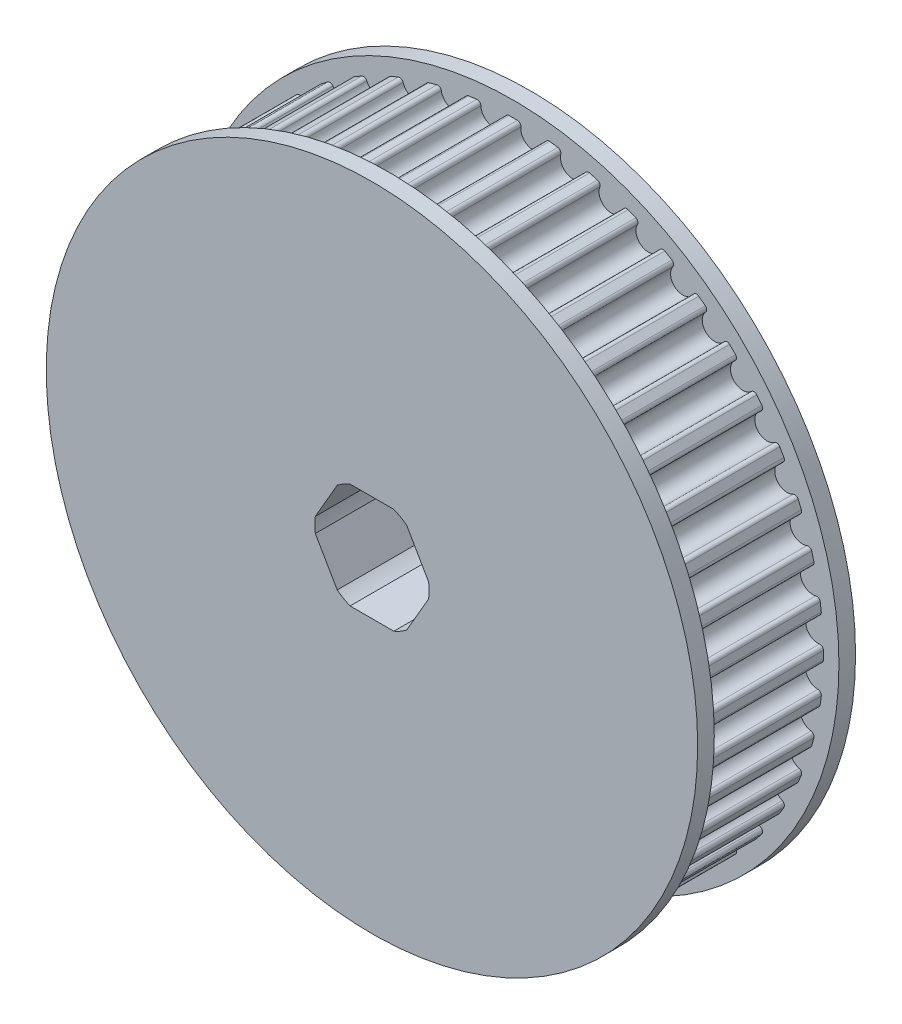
SolidWorks part; units mm, degrees
ref_plane "Front Plane" through (0, 0, 0) normal (0, 0, 1) x (1, 0, 0)
ref_plane "Top Plane" through (0, 0, 0) normal (0, 1, 0) x (1, 0, 0)
ref_plane "Right Plane" through (0, 0, 0) normal (1, 0, 0) x (0, 0, -1)
sketch "Sketch2" plane through (0, 0, 0) normal (0, 0, 1) x (1, 0, 0)
  circle A0 centre (0, 0) radius 38.1972
extrude "PD" add sketch "Sketch2" along normal mid plane 15
sketch "Sketch3" plane through (0, 0, 7.5) normal (0, 0, 1) x (1, 0, 0)
  line L0 (0, 0) -> (0, 37.3272) construction
  line L1 (0, 0) -> (2.404, 36.6785) construction
  line L2 (0, 37.3272) -> (0.4965, 37.3272)
  line L3 (0, 37.3272) -> (0, 38.1972)
  line L4 (4.8722, 37.0078) -> (4.9857, 37.8704)
  line L5 (4.8722, 37.0078) -> (4.3799, 37.0727)
  line L6 (2.404, 36.6785) -> (2.4982, 38.1154) construction
  arc A0 (0.4965, 37.3272) -> (0.9237, 36.8482) centre (0.4965, 36.8972) cw
  arc A1 (0.9237, 36.8482) -> (3.8938, 36.6535) centre (2.404, 36.6785) ccw
  circle A2 centre (0, 0) radius 38.1972 construction
  arc A3 (0, 38.1972) -> (4.9857, 37.8704) centre (0, 0) cw
  arc A4 (4.3799, 37.0727) -> (3.8938, 36.6535) centre (4.3238, 36.6463) ccw
  point P8 (2.3066, 35.1917)
extrude "Teeth" cut sketch "Sketch3" against normal up to surface (15 mm away)
pattern_circular "CirPattern1" count 48 over 360 about axis through (0, 0, 0) along (0, 0, 1) of "Teeth"
sketch "Sketch4" plane through (0, 0, 7.5) normal (0, 0, 1) x (1, 0, 0)
  circle A0 centre (0, 0) radius 39.1972
extrude "Flange" add sketch "Sketch4" along normal blind 2
mirror "Flange 2" about plane through (0, 0, 0) normal (0, 0, 1) of "Flange"
sketch "Sketch6" plane through (0, 0, 0) normal (0, 0, 1) x (1, 0, 0)
  line L1 (6.8168, 0.893) -> (4.1818, 5.457)
  line L2 (2.635, 6.35) -> (-2.635, 6.35)
  line L3 (-4.1818, 5.457) -> (-6.8168, 0.893)
  line L4 (-6.8168, -0.893) -> (-4.1818, -5.457)
  line L5 (-2.635, -6.35) -> (2.635, -6.35)
  line L6 (4.1818, -5.457) -> (6.8168, -0.893)
  circle A0 centre (0, 0) radius 6.35 construction
  arc A1 (-2.635, 6.35) -> (-4.1818, 5.457) centre (0, 0) ccw
  arc A2 (-6.8168, 0.893) -> (-6.8168, -0.893) centre (0, 0) ccw
  arc A3 (-4.1818, -5.457) -> (-2.635, -6.35) centre (0, 0) ccw
  arc A4 (2.635, -6.35) -> (4.1818, -5.457) centre (0, 0) ccw
  arc A5 (6.8168, -0.893) -> (6.8168, 0.893) centre (0, 0) ccw
  arc A6 (4.1818, 5.457) -> (2.635, 6.35) centre (0, 0) ccw
  dimension "D2" = 13.75
  dimension "D1" = 12.7
extrude "Cut-Extrude2" cut sketch "Sketch6" against normal through all both and the other way through all
equation "\"D1@Sketch4\"= 16 + 2"
equation "\"D1@CirPattern1\" = 16"
equation "\"D4@Sketch3\" = 180 / 16"
equation "\"D1@Sketch2\" = 16 * 5 / pi"
